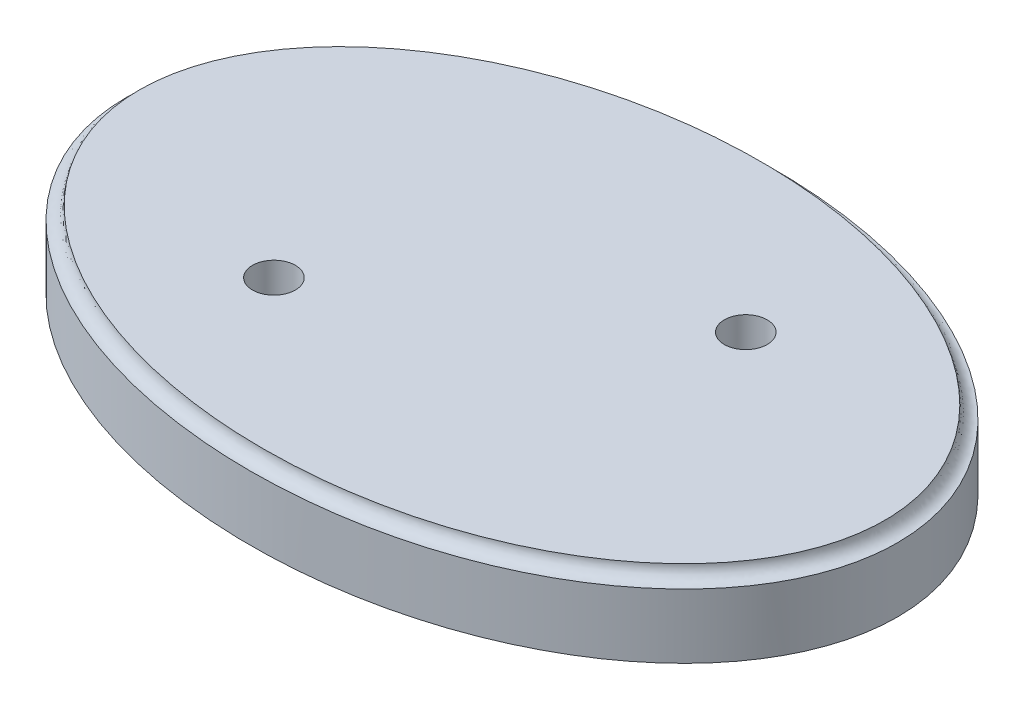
SolidWorks part; units mm, degrees
ref_plane "Front Plane" through (0, 0, 0) normal (0, 0, 1) x (1, 0, 0)
ref_plane "Top Plane" through (0, 0, 0) normal (0, 1, 0) x (1, 0, 0)
ref_plane "Right Plane" through (0, 0, 0) normal (1, 0, 0) x (0, 0, -1)
sketch "Sketch1" plane through (0, 0, 0) normal (0, 1, 0) x (1, 0, 0)
  ellipse E0 centre (0, 0) end of major axis (44.95, 0) minor radius 30.5
  dimension "D1" = 61
  dimension "D2" = 89.9
extrude "Boss-Extrude1" add sketch "Sketch1" against normal blind 9
sketch "Sketch2" plane through (0, 0, 0) normal (0, 1, 0) x (1, 0, 0)
  ellipse E0 centre (0, 0) end of major axis (44.95, 0) minor radius 30.5
  ellipse E1 centre (0, 0) end of major axis (44.95, 0) minor radius 30.5 construction
  dimension "D1" = 61
sketch "Sketch3" plane through (0, 0, 0) normal (1, 0, 0) x (0, 0, -1)
  circle A0 centre (-30.5, 0) radius 1.5
  dimension "D1" = 3
sweep "Cut-Sweep1" cut profiles "Sketch3" path "Sketch2"
sketch "Sketch4" plane through (0, -9, 0) normal (0, -1, 0) x (1, 0, 0)
  line L0 (44.95, -30.5) -> (44.95, 30.5) construction
  line L1 (-41.963, 30.5) -> (44.95, 30.5) construction
hole_wizard "Ø4.0mm Dowel Hole1" positions "Sketch6" profile "Sketch5" hole size "Ø4.0" standard "ANSI Metric"
sketch "Sketch6" plane through (0, -9, 0) normal (0, -1, 0) x (-1, 0, 0)
  line L0 (-44.95, 30.5) -> (-44.95, -30.5) construction
  line L1 (41.963, -30.5) -> (-44.95, -30.5) construction
  point P0 (26.75, -15.6)
  point P2 (26.75, 15.2)
  point P4 (-26.75, 15.2)
  point P6 (-26.75, -16.9322)
  dimension "D1" = 71.7
  dimension "D2" = 53.5
  dimension "D3" = 30.8
  dimension "D4" = 14.9
sketch "Sketch5" plane through (-26.75, -9, 15.6) normal (1, 0, 0) x (0, 0, -1)
  line L0 (0, 0) -> (0, 7.2017)
  line L1 (0, 7.2017) -> (2, 6)
  line L2 (2, 6) -> (2, 0.5)
  line L3 (2, 0.5) -> (2.5, 0)
  line L5 (2.5, 0) -> (0, 0)
  line L6 (-2, 0.5) -> (-2.5, 0) construction
  line L10 (0, 7.2017) -> (-2, 6) construction
  line L11 (0, -6.35) -> (0, 107.95) construction
  dimension "Hole Dia." = 4
  dimension "Hole Depth" = 6
  dimension "Near C'Sink Dia." = 5
  dimension "Near C'Sink Angle" = 90
  dimension "Drill Angle" = 118
hole_wizard "Ø5.0mm Dowel Hole1" positions "Sketch8" profile "Sketch7" hole size "Ø5.0" standard "ANSI Metric"
sketch "Sketch8" plane through (0, -9, 0) normal (0, -1, 0) x (-1, 0, 0)
  line L0 (41.963, -30.5) -> (-44.95, -30.5) construction
  line L1 (-44.95, 30.5) -> (-44.95, -30.5) construction
  line L2 (-44.95, 30.5) -> (0, 30.5) construction
  ellipse E0 centre (0, 0) end of major axis (-44.95, 0) minor radius 30.5 construction
  ellipse E1 centre (0, 0) end of major axis (-44.95, 0) minor radius 30.5 construction
  point P0 (-16.35, 10.9)
  point P7 (16.65, -11.1)
  dimension "D1" = 41.4
  dimension "D2" = 28.6
  dimension "D3" = 33
  dimension "D4" = 19.4
sketch "Sketch7" plane through (16.35, -9, -10.9) normal (1, 0, 0) x (0, 0, -1)
  line L0 (0, 0) -> (0, 9.3948)
  line L1 (0, 9.3948) -> (2.5, 9.3948)
  line L2 (2.5, 9.3948) -> (2.5, 1.5)
  line L3 (2.5, 1.5) -> (4, 0)
  line L5 (4, 0) -> (0, 0)
  line L6 (-2.5, 1.5) -> (-4, 0) construction
  line L11 (0, -6.35) -> (0, 107.95) construction
  dimension "Thru Hole Dia." = 5
  dimension "Thru Hole Depth" = 9.3948
  dimension "Near C'Sink Dia." = 8
  dimension "Near C'Sink Angle" = 90
